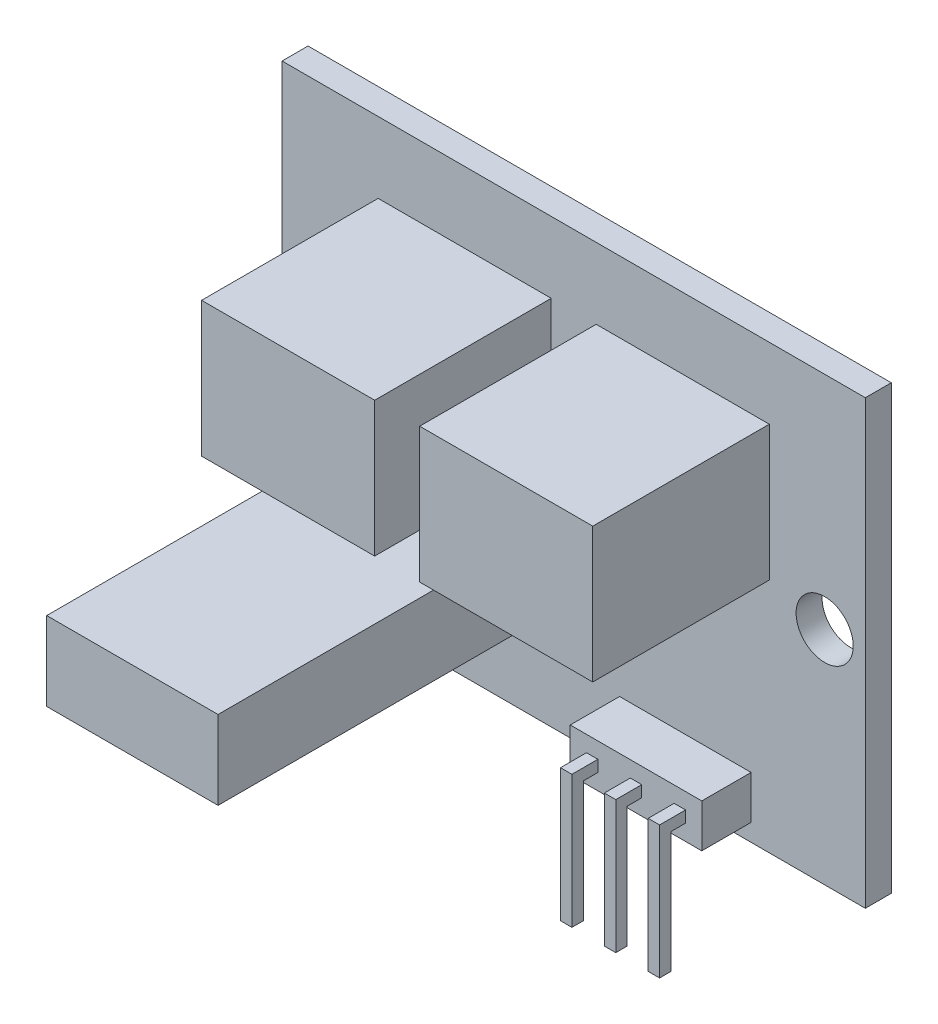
SolidWorks part; units mm, degrees
ref_plane "Płaszczyzna przednia" through (0, 0, 0) normal (0, 0, 1) x (1, 0, 0)
ref_plane "Płaszczyzna górna" through (0, 0, 0) normal (0, 1, 0) x (1, 0, 0)
ref_plane "Płaszczyzna prawa" through (0, 0, 0) normal (1, 0, 0) x (0, 0, -1)
sketch "Szkic1" plane through (0, 0, 0) normal (0, 0, 1) x (1, 0, 0)
  line L0 (2.35, 12.775) -> (31.35, 12.775) construction
  line L1 (0, 0) -> (33.7, 0)
  line L2 (0, 0) -> (0, 25.55)
  line L3 (0, 25.55) -> (33.7, 25.55)
  line L4 (33.7, 0) -> (33.7, 25.55)
  line L5 (31.35, 12.775) -> (2.35, 12.775) construction
  circle A0 centre (31.35, 12.775) radius 1.65
  circle A1 centre (2.35, 12.775) radius 1.65
  point P5 (16.85, 12.775)
  point P6 (16.85, 25.55)
  point P11 (0, 12.775)
  dimension "D3" = 3.3
  dimension "D1" = 25.55
  dimension "D2" = 33.7
  dimension "D4" = 29
extrude "Dodanie-wyciągnięcie1" add sketch "Szkic1" along normal blind 1.5
sketch "Szkic2" plane through (0, 0, 1.5) normal (0, 0, 1) x (1, 0, 0)
  line L0 (16.85, 25.55) -> (16.85, 0) construction
  line L1 (5.55, 21.45) -> (15.55, 21.45)
  line L2 (5.55, 21.45) -> (5.55, 13.65)
  line L3 (5.55, 13.65) -> (15.55, 13.65)
  line L4 (15.55, 21.45) -> (15.55, 13.65)
  line L5 (33.7, 25.55) -> (0, 25.55) construction
  line L6 (0, 0) -> (33.7, 0) construction
  line L7 (18.15, 21.45) -> (18.15, 13.65)
  line L8 (28.15, 13.65) -> (18.15, 13.65)
  line L9 (28.15, 21.45) -> (28.15, 13.65)
  line L10 (28.15, 21.45) -> (18.15, 21.45)
  dimension "D1" = 2.6
  dimension "D2" = 10
  dimension "D3" = 4.1
  dimension "D4" = 7.8
extrude "Dodanie-wyciągnięcie2" add sketch "Szkic2" along normal blind 10.2
sketch "Szkic3" plane through (0, 0, 1.5) normal (0, 0, 1) x (1, 0, 0)
  line L0 (0, 25.55) -> (0, 0) construction
  line L1 (5.4, 10) -> (15.3, 10)
  line L2 (5.4, 10) -> (5.4, 5.45)
  line L3 (5.4, 5.45) -> (15.3, 5.45)
  line L4 (15.3, 10) -> (15.3, 5.45)
  line L5 (0, 0) -> (33.7, 0) construction
  dimension "D1" = 4.55
  dimension "D2" = 9.9
  dimension "D3" = 15.3
  dimension "D4" = 10
extrude "Dodanie-wyciągnięcie3" add sketch "Szkic3" along normal blind 19
sketch "Szkic4" plane through (0, 0, 1.5) normal (0, 0, 1) x (1, 0, 0)
  line L0 (0, 0) -> (33.7, 0) construction
  line L1 (19.5, 3.5) -> (27.1, 3.5)
  line L2 (19.5, 3.5) -> (19.5, 1)
  line L3 (19.5, 1) -> (27.1, 1)
  line L4 (27.1, 3.5) -> (27.1, 1)
  line L5 (33.7, 0) -> (33.7, 25.55) construction
  dimension "D1" = 7.6
  dimension "D2" = 2.5
  dimension "D3" = 3.5
  dimension "D4" = 14.2
extrude "Dodanie-wyciągnięcie4" add sketch "Szkic4" along normal blind 2.85
sketch "Szkic5" plane through (0, 0, 4.35) normal (0, 0, 1) x (1, 0, 0)
  line L0 (22.0333, 3.5) -> (22.0333, 1) construction
  line L1 (20.4367, 2.58) -> (21.0967, 2.58)
  line L2 (20.4367, 2.58) -> (20.4367, 1.92)
  line L3 (20.4367, 1.92) -> (21.0967, 1.92)
  line L4 (21.0967, 2.58) -> (21.0967, 1.92)
  line L5 (27.1, 3.5) -> (19.5, 3.5) construction
  line L6 (19.5, 1) -> (27.1, 1) construction
  line L8 (24.5667, 3.5) -> (24.5667, 1) construction
  line L9 (19.5, 2.25) -> (22.0333, 2.25) construction
  line L10 (19.5, 3.5) -> (19.5, 1) construction
  line L11 (22.0333, 2.25) -> (24.5667, 2.25) construction
  line L12 (24.5667, 2.25) -> (27.1, 2.25) construction
  line L13 (27.1, 1) -> (27.1, 3.5) construction
  line L14 (22.97, 2.58) -> (22.97, 1.92)
  line L15 (23.63, 1.92) -> (22.97, 1.92)
  line L16 (23.63, 2.58) -> (23.63, 1.92)
  line L17 (23.63, 2.58) -> (22.97, 2.58)
  line L18 (25.5033, 2.58) -> (26.1633, 2.58)
  line L19 (25.5033, 2.58) -> (25.5033, 1.92)
  line L20 (25.5033, 1.92) -> (26.1633, 1.92)
  line L21 (26.1633, 2.58) -> (26.1633, 1.92)
  point P16 (20.4367, 2.25)
  point P21 (20.7667, 2.58)
  point P22 (20.7667, 2.25)
  dimension "D1" = 0.66
extrude "Dodanie-wyciągnięcie5" add sketch "Szkic5" along normal blind 1.5
sketch "Szkic6" plane through (0, 1.92, 0) normal (0, -1, 0) x (1, 0, 0)
  line L0 (21.0967, 5.85) -> (21.0967, 4.35) construction
  line L1 (20.4367, 5.85) -> (21.0967, 5.85)
  line L2 (20.4367, 5.85) -> (20.4367, 5.19)
  line L3 (20.4367, 5.19) -> (21.0967, 5.19)
  line L4 (21.0967, 5.85) -> (21.0967, 5.19)
  line L5 (23.63, 5.85) -> (23.63, 4.35) construction
  line L6 (22.97, 5.85) -> (23.63, 5.85)
  line L7 (22.97, 5.85) -> (22.97, 5.19)
  line L8 (22.97, 5.19) -> (23.63, 5.19)
  line L9 (23.63, 5.85) -> (23.63, 5.19)
  line L10 (25.5033, 5.85) -> (25.5033, 4.35) construction
  line L11 (25.5033, 5.85) -> (26.1633, 5.85)
  line L12 (25.5033, 5.85) -> (25.5033, 5.19)
  line L13 (25.5033, 5.19) -> (26.1633, 5.19)
  line L14 (26.1633, 5.85) -> (26.1633, 5.19)
  line L15 (26.1633, 5.85) -> (26.1633, 4.35) construction
  line L16 (25.5033, 5.85) -> (26.1633, 5.85) construction
extrude "Dodanie-wyciągnięcie6" add sketch "Szkic6" along normal blind 7
